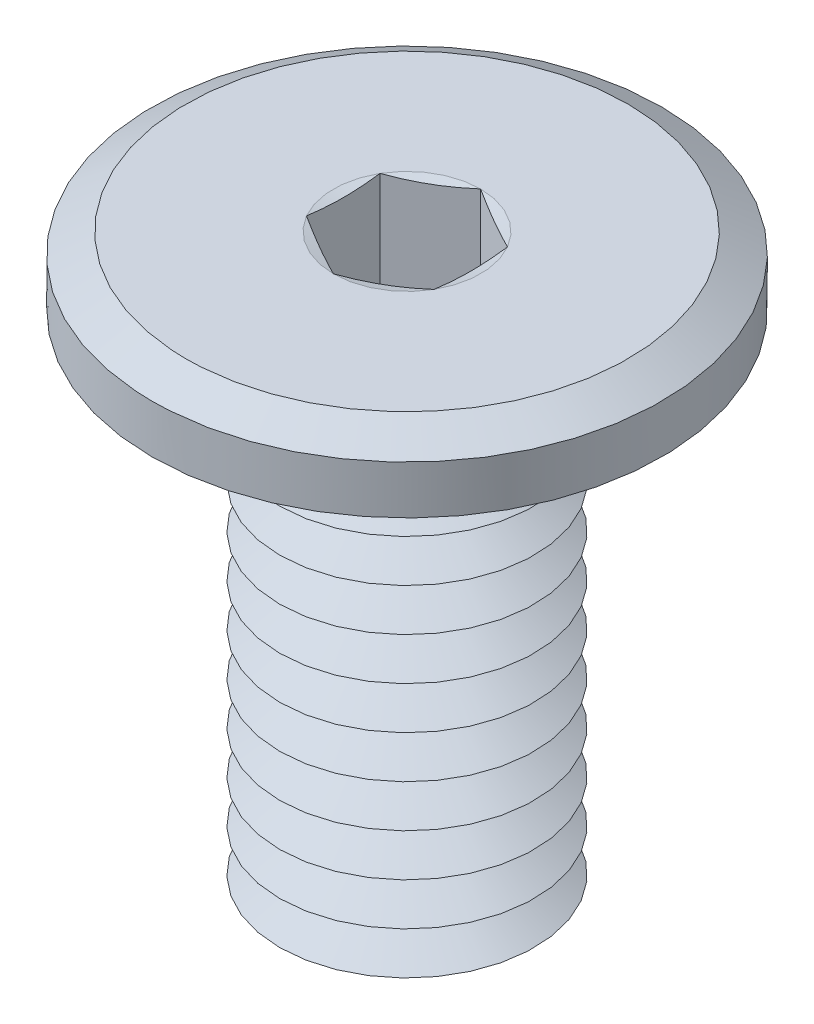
SolidWorks part; units mm, degrees
ref_plane "Front Plane" through (0, 0, 0) normal (0, 0, 1) x (1, 0, 0)
ref_plane "Top Plane" through (0, 0, 0) normal (0, 1, 0) x (1, 0, 0)
ref_plane "Right Plane" through (0, 0, 0) normal (1, 0, 0) x (0, 0, -1)
sketch "Sketch1" plane through (0, 0, 0) normal (0, 1, 0) x (1, 0, 0)
  circle A0 centre (0, 0) radius 3
  dimension "D1" = 6
extrude "Boss-Extrude1" add sketch "Sketch1" against normal blind 0.8
sketch "Sketch2" plane through (0, -0.8, 0) normal (0, -1, 0) x (1, 0, 0)
  circle A0 centre (0, 0) radius 1.5
  dimension "D1" = 3
extrude "Boss-Extrude2" add sketch "Sketch2" along normal blind 6
sketch "Sketch3" plane through (0, 0, 0) normal (1, 0, 0) x (0, 0, -1)
  line L0 (0, 0.9906) -> (0, -8.2999) construction
sketch "Sketch5" plane through (0, 0, 0) normal (1, 0, 0) x (0, 0, -1)
  line L0 (-1.5, -7.05) -> (-1.067, -6.8)
  line L1 (-1.5, -0.8) -> (-1.5, -6.8) construction
  line L2 (-1.067, -6.8) -> (-1.5, -6.55)
  line L3 (-1.5, -0.8) -> (-1.5, -6.8) construction
  line L4 (-1.5, -6.55) -> (-1.5, -7.05)
  line L6 (-1.5, -0.8) -> (-1.5, -6.8) construction
  line L7 (-1.5, -0.8) -> (-1.5, -6.8) construction
  line L14 (-1.5, -6.8) -> (1.5, -6.8) construction
  dimension "D1" = 0.5
revolve "Cut-Revolve1" cut sketch "Sketch5" angle 360 about L0
pattern_linear "LPattern1" count 11 spacing 0.5 along (0, 1, 0) of "Cut-Revolve1"
fillet "Fillet1" radius 0.1 1 edges at (0, -0.8, -1.5)
chamfer "Chamfer2" distance 0.4 angle 30 1 edges at (0, 0, 3)
sketch "Sketch6" plane through (0, 0, 0) normal (0, 1, 0) x (1, 0, 0)
  line L1 (0, 0.866) -> (-0.75, 0.433)
  line L2 (-0.75, 0.433) -> (-0.75, -0.433)
  line L3 (-0.75, -0.433) -> (0, -0.866)
  line L4 (0, -0.866) -> (0.75, -0.433)
  line L5 (0.75, -0.433) -> (0.75, 0.433)
  line L6 (0.75, 0.433) -> (0, 0.866)
  circle A0 centre (0, 0) radius 0.75 construction
  dimension "D1" = 1.5
extrude "Cut-Extrude1" cut sketch "Sketch6" against normal blind 1.4
sketch "Sketch7" plane through (0, -1.4, 0) normal (0, 1, 0) x (1, 0, 0)
  line L0 (-0.75, 0.433) -> (-0.75, -0.433) construction
  circle A0 centre (0, 0) radius 0.75
extrude "Cut-Extrude2" cut sketch "Sketch7" against normal through all draft 60
sketch "Sketch8" plane through (0, 0, 0) normal (0, 1, 0) x (1, 0, 0)
  circle A0 centre (0, 0) radius 0.866
extrude "Cut-Extrude3" cut sketch "Sketch8" against normal through all draft 75
